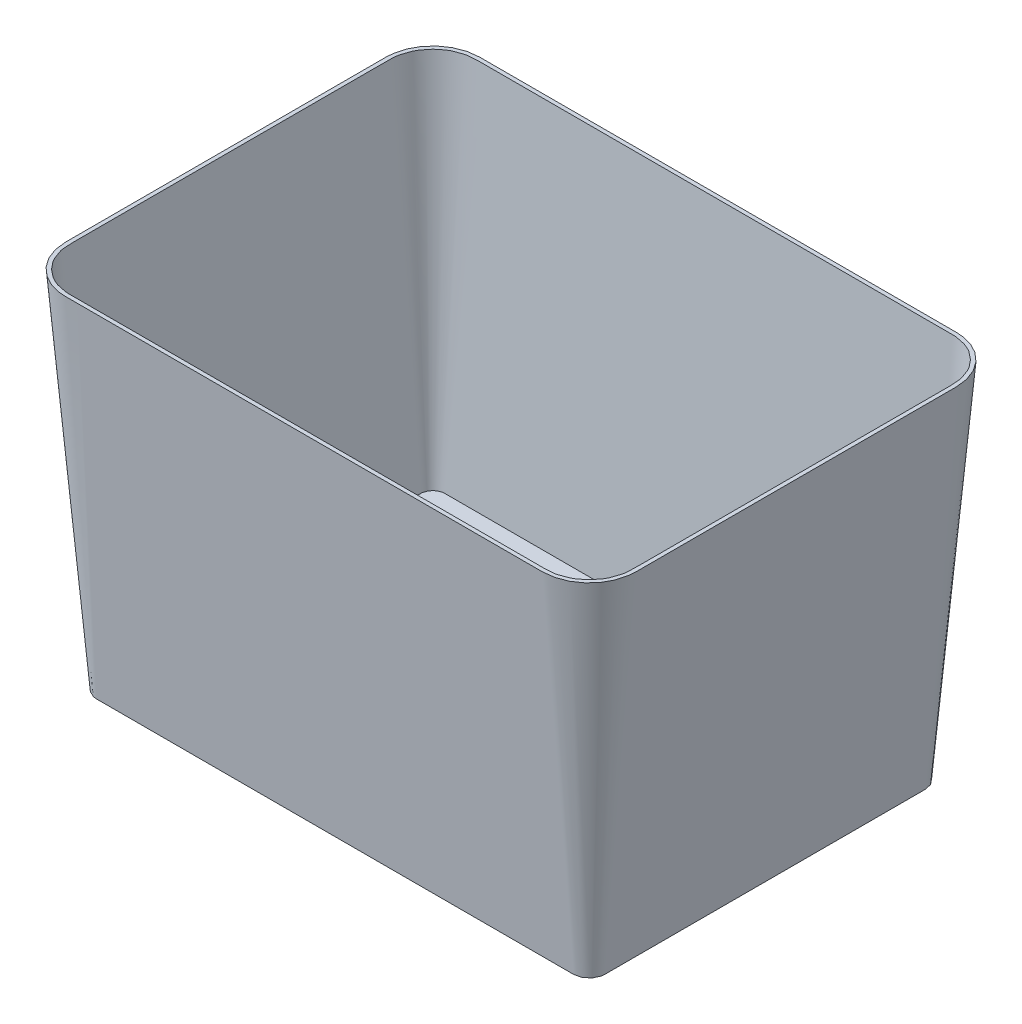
SolidWorks part; units mm, degrees
ref_plane "Front" through (0, 0, 0) normal (0, 0, 1) x (1, 0, 0)
ref_plane "Top" through (0, 0, 0) normal (0, 1, 0) x (1, 0, 0)
ref_plane "Right" through (0, 0, 0) normal (1, 0, 0) x (0, 0, -1)
sketch "Sketch1" plane through (0, 0, 0) normal (0, 1, 0) x (1, 0, 0)
  line L1 (193.675, -142.875) -> (-193.675, -142.875)
  line L2 (206.375, -130.175) -> (206.375, 130.175)
  line L3 (193.675, 142.875) -> (-193.675, 142.875)
  line L4 (-206.375, -130.175) -> (-206.375, 130.175)
  line L5 (206.375, -142.875) -> (-206.375, 142.875) construction
  line L6 (206.375, 142.875) -> (-206.375, -142.875) construction
  arc A0 (206.375, 130.175) -> (193.675, 142.875) centre (193.675, 130.175) ccw
  arc A1 (206.375, -130.175) -> (193.675, -142.875) centre (193.675, -130.175) cw
  arc A2 (-193.675, -142.875) -> (-206.375, -130.175) centre (-193.675, -130.175) cw
  arc A3 (-193.675, 142.875) -> (-206.375, 130.175) centre (-193.675, 130.175) ccw
  point P0 (0, 0)
  dimension "D3" = 12.7
  dimension "D1" = 285.75
  dimension "D2" = 412.75
ref_plane "Plane1" through (0, 295.91, 0) normal (0, 1, 0) x (1, 0, 0)
sketch "Sketch3" plane through (0, 295.91, 0) normal (0, 1, 0) x (1, 0, 0)
  line L8 (231.775, -130.175) -> (231.775, 130.175)
  line L9 (193.675, 168.275) -> (-193.675, 168.275)
  line L10 (-231.775, 130.175) -> (-231.775, -130.175)
  line L11 (-193.675, -168.275) -> (193.675, -168.275)
  line L12 (231.775, -130.175) -> (231.775, 130.175)
  line L13 (193.675, 168.275) -> (-193.675, 168.275)
  line L14 (-231.775, 130.175) -> (-231.775, -130.175)
  line L15 (-193.675, -168.275) -> (193.675, -168.275)
  arc A8 (231.775, 130.175) -> (193.675, 168.275) centre (193.675, 130.175) ccw
  arc A9 (-193.675, 168.275) -> (-231.775, 130.175) centre (-193.675, 130.175) ccw
  arc A10 (-231.775, -130.175) -> (-193.675, -168.275) centre (-193.675, -130.175) ccw
  arc A11 (193.675, -168.275) -> (231.775, -130.175) centre (193.675, -130.175) ccw
  arc A12 (231.775, 130.175) -> (193.675, 168.275) centre (193.675, 130.175) ccw
  arc A13 (-193.675, 168.275) -> (-231.775, 130.175) centre (-193.675, 130.175) ccw
  arc A14 (-231.775, -130.175) -> (-193.675, -168.275) centre (-193.675, -130.175) ccw
  arc A15 (193.675, -168.275) -> (231.775, -130.175) centre (193.675, -130.175) ccw
  dimension "D1" = 25.4
loft "Loft1" add profiles "Sketch3", "Sketch1"
shell "Shell1" thickness 3.175
